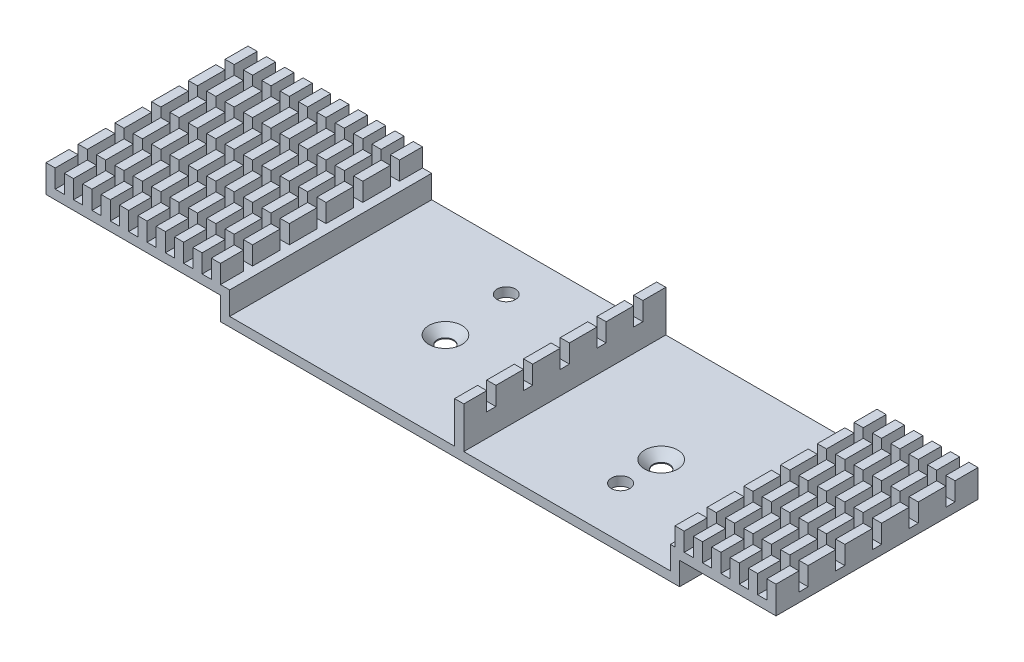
SolidWorks part; units mm, degrees
ref_plane "Plan de face" through (0, 0, 0) normal (0, 0, 1) x (1, 0, 0)
ref_plane "Plan de dessus" through (0, 0, 0) normal (0, 1, 0) x (1, 0, 0)
ref_plane "Plan de droite" through (0, 0, 0) normal (1, 0, 0) x (0, 0, -1)
sketch "Esquisse1" plane through (0, 0, 0) normal (0, 1, 0) x (1, 0, 0)
  line L0 (37.75, 0) -> (-25.25, 0) construction
  line L1 (-23.25, 22) -> (25.75, 22)
  line L2 (-23.25, 22) -> (-23.25, 0)
  line L3 (-23.25, 0) -> (25.75, 0)
  line L4 (25.75, 22) -> (25.75, 0)
  dimension "D1" = 22
  dimension "D2" = 49
  dimension "D3" = 25.75
extrude "Boss.-Extru.1" add sketch "Esquisse1" along normal blind 1
hole_wizard "Fraisage pour vis à tête fraisée M1.61" positions "Esquisse3D1" profile "Esquisse3" countersink size "M1.6" standard "ISO"
sketch3d "Esquisse3D1"
  line L0 (-23.25, 1, 0) -> (25.75, 1, 0) construction
  line L1 (25.75, 1, 0) -> (25.75, 1, -22) construction
  point P0 (14.75, 1, -10)
  point P2 (-8.75, 1, -10)
  dimension "D1" = 10
  dimension "D2" = 11
  dimension "D3" = 23.5
  dimension "D4" = 10
sketch "Esquisse3" plane through (14.75, 1, -10) normal (1, 0, 0) x (0, 0, 1)
  line L0 (0, 0) -> (0, 1)
  line L1 (0, 1) -> (0.9, 1)
  line L2 (0.9, 1) -> (0.9, 0.9)
  line L3 (0.9, 0.9) -> (1.8, 0)
  line L5 (1.8, 0) -> (0, 0)
  line L6 (-0.9, 0.9) -> (-1.8, 0) construction
  line L11 (0, -6.35) -> (0, 107.95) construction
  dimension "Diamètre du perçage jusqu'au prochain" = 1.8
  dimension "Profondeur du perçage jusqu'au prochain" = 1
  dimension "Diamètre du fraisage entrant" = 3.6
  dimension "Angle du fraisage entrant" = 90
sketch "Esquisse4" plane through (0, 1, 0) normal (0, 1, 0) x (1, 0, 0)
  circle A0 centre (-9.275, 17.15) radius 1
  circle A1 centre (14.775, 5.55) radius 1
  dimension "D1" = 2
  dimension "D2" = 2
extrude "Enlèv. mat.-Extru.1" cut sketch "Esquisse4" against normal through all
sketch "Esquisse5" plane through (0, 0, -22) normal (0, 0, -1) x (-1, 0, 0)
  line L1 (-25.75, 1) -> (23.25, 1) construction
  line L2 (22.25, 1) -> (23.25, 1)
  line L3 (23.25, 1) -> (23.25, 2.5)
  line L4 (23.25, 2.5) -> (42.25, 2.5)
  line L9 (22.25, 1) -> (22.25, 3.5)
  line L10 (22.25, 3.5) -> (42.25, 3.5)
  line L13 (42.25, 3.5) -> (42.25, 2.5)
  dimension "D1" = 20
  dimension "D2" = 2.5
  dimension "D3" = 1
  dimension "D4" = 1
extrude "Boss.-Extru.2" add sketch "Esquisse5" against normal up to surface (22 mm away)
sketch "Esquisse6" plane through (0, 0, 0) normal (0, 0, 1) x (1, 0, 0)
  line L1 (-42.25, 3.5) -> (-41.25, 3.5)
  line L2 (-42.25, 3.5) -> (-42.25, 5.5)
  line L3 (-42.25, 5.5) -> (-41.25, 5.5)
  line L4 (-41.25, 3.5) -> (-41.25, 5.5)
  dimension "D1" = 1
  dimension "D2" = 2
extrude "Boss.-Extru.3" add sketch "Esquisse6" against normal up to surface (22 mm away)
pattern_linear "Répétition linéaire1" count 10 spacing 2 along (1, 0, 0) of "Boss.-Extru.3"
sketch "Esquisse7" plane through (0, 0, 0) normal (0, 0, 1) x (1, 0, 0)
  line L0 (25.75, 0) -> (26.75, 0)
  line L1 (26.75, 0) -> (26.75, 2.5)
  line L2 (26.75, 2.5) -> (37.25, 2.5)
  line L3 (37.25, 2.5) -> (37.25, 3.5)
  line L4 (37.25, 3.5) -> (25.75, 3.5)
  line L5 (25.75, 3.5) -> (25.75, 0)
  dimension "D1" = 1
  dimension "D2" = 2.5
  dimension "D3" = 1
  dimension "D4" = 11.5
extrude "Boss.-Extru.4" add sketch "Esquisse7" against normal up to surface (22 mm away)
sketch "Esquisse8" plane through (0, 0, -22) normal (0, 0, -1) x (-1, 0, 0)
  line L1 (-37.25, 3.5) -> (-36.25, 3.5)
  line L2 (-37.25, 3.5) -> (-37.25, 5.5)
  line L3 (-37.25, 5.5) -> (-36.25, 5.5)
  line L4 (-36.25, 3.5) -> (-36.25, 5.5)
  dimension "D1" = 1
  dimension "D2" = 2
extrude "Boss.-Extru.5" add sketch "Esquisse8" against normal up to surface (22 mm away)
pattern_linear "Répétition linéaire2" count 6 spacing 2 along (-1, 0, 0) of "Boss.-Extru.5"
sketch "Esquisse9" plane through (0, 0, -22) normal (0, 0, -1) x (-1, 0, 0)
  line L1 (-25.75, 1) -> (22.25, 1) construction
  line L2 (-2.25, 1) -> (-3.25, 1)
  line L3 (-2.25, 1) -> (-2.25, 5.5)
  line L4 (-2.25, 5.5) -> (-3.25, 5.5)
  line L5 (-3.25, 1) -> (-3.25, 5.5)
  line L6 (-2.75, 7.655) -> (-2.75, 0.1269) construction
  dimension "D1" = 1
  dimension "D2" = 4.5
extrude "Boss.-Extru.6" add sketch "Esquisse9" against normal up to surface (22 mm away)
sketch "Esquisse10" plane through (-42.25, 0, 0) normal (-1, 0, 0) x (0, 0, 1)
  line L0 (-11, -1.7102) -> (-11, 8.7251) construction
  line L1 (-10.5, 3.5) -> (-11.5, 3.5)
  line L2 (-10.5, 3.5) -> (-10.5, 5.5)
  line L3 (-10.5, 5.5) -> (-11.5, 5.5)
  line L4 (-11.5, 3.5) -> (-11.5, 5.5)
  line L5 (-22, 5.5) -> (0, 5.5) construction
  line L6 (-22, 3.5) -> (0, 3.5) construction
  dimension "D1" = 1
extrude "Enlèv. mat.-Extru.2" cut sketch "Esquisse10" against normal through all
pattern_linear "Répétition linéaire3" count 3 spacing 4 along (0, 0, 1) of "Enlèv. mat.-Extru.2"
pattern_linear "Répétition linéaire4" count 3 spacing 4 along (0, 0, -1) of "Répétition linéaire3"
